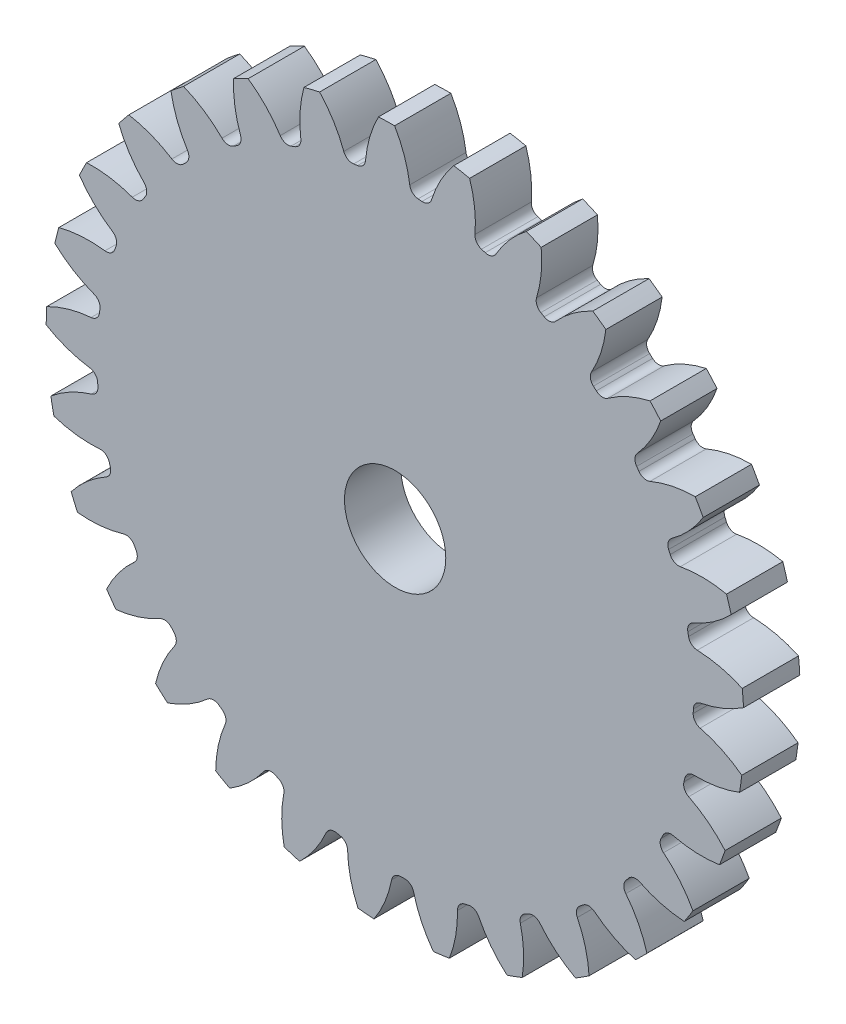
SolidWorks part; units mm, degrees
ref_plane "Front" through (0, 0, 0) normal (0, 0, 1) x (1, 0, 0)
ref_plane "Top" through (0, 0, 0) normal (0, 1, 0) x (1, 0, 0)
ref_plane "Right" through (0, 0, 0) normal (1, 0, 0) x (0, 0, -1)
sketch "Sketch3" plane through (0, 0, 0) normal (0, 0, 1) x (1, 0, 0)
  circle A0 centre (0, 0) radius 787.4
  dimension "od" = 1574.8
extrude "gearBody" add sketch "Sketch3" along normal blind 127
sketch "Sketch2" plane through (0, 0, 0) normal (0, 0, 1) x (1, 0, 0)
  line L0 (0, 0) -> (639.4887, 264.8849) construction
  line L1 (783.3885, -91.0722) -> (0, 0) construction
  line L2 (0, 0) -> (36.3143, 0) construction
  line L3 (736.3822, 17.9107) -> (734.0387, -61.374) construction
  line L5 (735.2104, -21.7317) -> (0, 0) construction
  line L7 (0, 0) -> (692.1776, 0) construction
  arc A0 (692.1605, 4.8651) -> (690.6647, -45.7392) centre (0, 0) ccw construction
  arc A1 (786.1793, 43.8273) -> (782.2181, -90.1866) centre (0, 0) ccw construction
  arc A2 (736.3822, 17.9107) -> (734.0387, -61.374) centre (0, 0) ccw construction
  arc A3 (672.6605, -24.3209) -> (672.9226, -15.4524) centre (0, 0) ccw
  arc A4 (783.3885, -91.0722) -> (688.2186, -45.1037) centre (622.7267, -302.194) ccw
  arc A5 (783.3885, -91.0722) -> (787.4, 44.6422) centre (0, 0) ccw
  arc A6 (787.4, 44.6422) -> (689.6811, 4.3751) centre (639.4887, 264.8849) cw
  arc A7 (672.9226, -15.4524) -> (689.6811, 4.3751) centre (693.5928, -15.9271) cw
  arc A8 (688.2186, -45.1037) -> (672.6605, -24.3209) centre (693.3226, -25.068) cw
  point P6 (787.4, 44.6422)
  point P22 (783.3885, -91.0722)
  dimension "baseDia" = 1384.3552
  dimension "od" = 1574.8
  dimension "pd" = 1473.2
  dimension "rd" = 1346.2
  dimension "rFillet" = 20.6756
  dimension "pointX" = 787.4
  dimension "pointY" = 44.6422
  dimension "CTT" = 79.2847
  dimension "flankCenterAngle" = 22.5
extrude "toothCut" cut sketch "Sketch2" along normal through all
pattern_circular "CirPattern1" count 29 over 360 about axis through (0, 0, 0) along (0, 0, 1) of "toothCut"
sketch "hub1Dia" plane through (0, 0, 0) normal (0, 0, -1) x (-1, 0, 0)
  circle A0 centre (0, 0) radius 12.7
  dimension "hub1Dia" = 25.4
sketch "hub2Dia" plane through (0, 0, 127) normal (0, 0, 1) x (1, 0, 0)
  circle A0 centre (0, 0) radius 12.7
  dimension "hub2dia" = 25.4
sketch "boreDia" plane through (0, 0, 0) normal (0, 0, 1) x (1, 0, 0)
  circle A0 centre (0, 0) radius 114.3
  dimension "boreDia" = 228.6
extrude "bore" cut sketch "boreDia" against normal mid plane 25400
